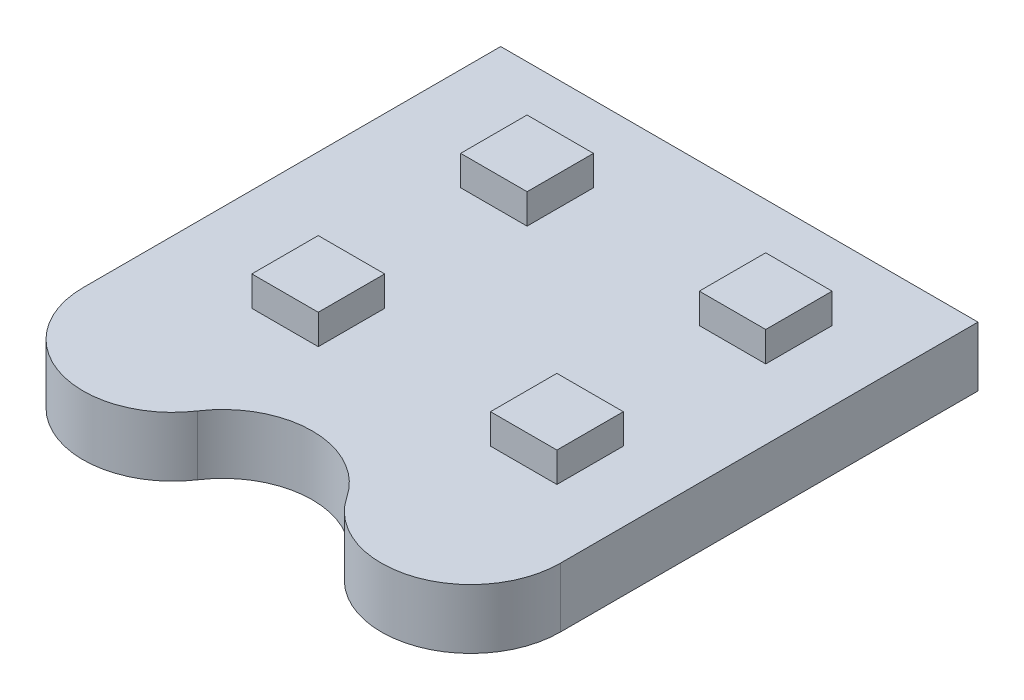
SolidWorks part; units mm, degrees
ref_plane "Front Plane" through (0, 0, 0) normal (0, 0, 1) x (1, 0, 0)
ref_plane "Top Plane" through (0, 0, 0) normal (0, 1, 0) x (1, 0, 0)
ref_plane "Right Plane" through (0, 0, 0) normal (1, 0, 0) x (0, 0, -1)
sketch "Sketch1" plane through (0, 0, 0) normal (0, 1, 0) x (1, 0, 0)
  line L0 (0, -88.9) -> (0, 0)
  line L1 (0, 0) -> (101.6, 0)
  line L2 (101.6, 0) -> (101.6, -88.9)
  arc A0 (0, -88.9) -> (34.925, -99.4303) centre (19.05, -88.9) ccw
  arc A1 (34.925, -99.4303) -> (66.675, -99.4303) centre (50.8, -109.9606) cw
  arc A2 (66.675, -99.4303) -> (101.6, -88.9) centre (82.55, -88.9) ccw
  dimension "D3" = 19.05
  dimension "D1" = 101.6
  dimension "D2" = 88.9
extrude "Extrude1" add sketch "Sketch1" along normal blind 12.7
sketch "Sketch3" plane through (0, 12.7, 0) normal (0, 1, 0) x (-1, 0, 0)
  line L1 (-86.7219, 16.1737) -> (-72.58, 16.1737)
  line L2 (-86.7219, 16.1737) -> (-86.7219, 30.3064)
  line L3 (-86.7219, 30.3064) -> (-72.58, 30.3064)
  line L4 (-72.58, 16.1737) -> (-72.58, 30.3064)
extrude "Extrude2" add sketch "Sketch3" along normal blind 6.35
pattern_linear "LPattern1" count 2 spacing 44.45 along (0, 0, 1) count 2 spacing 50.8 along (-1, 0, 0) of "Extrude2"
